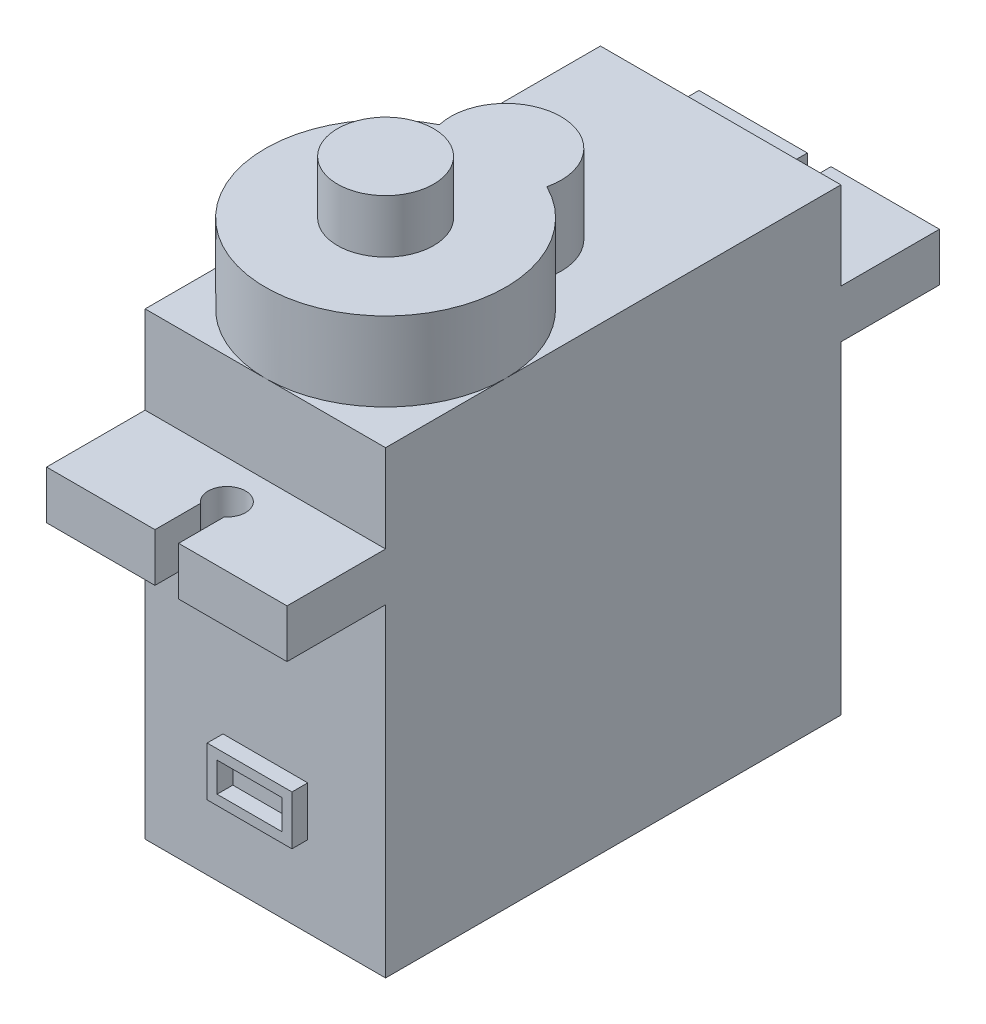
SolidWorks part; units mm, degrees
ref_plane "Plan de face" through (0, 0, 0) normal (0, 0, 1) x (1, 0, 0)
ref_plane "Plan de dessus" through (0, 0, 0) normal (0, 1, 0) x (1, 0, 0)
ref_plane "Plan de droite" through (0, 0, 0) normal (1, 0, 0) x (0, 0, -1)
sketch "Esquisse1" plane through (0, 0, 0) normal (1, 0, 0) x (0, 0, -1)
  line L0 (0, -9.5432) -> (0, 26.3061) construction
  line L1 (-6.5687, 0) -> (43.0147, 0) construction
  line L2 (-6.5687, 23.3) -> (43.0147, 23.3) construction
  line L3 (23.1, -9.5432) -> (23.1, 26.3061) construction
  line L4 (11.55, 26.3061) -> (11.55, 16.4856) construction
  line L5 (18.1943, 18.85) -> (34.5394, 18.85) construction
  line L6 (18.1943, 16.4) -> (34.5394, 16.4) construction
  line L7 (23.1, 23.3) -> (23.1, 18.85)
  line L8 (28.1, 26.3061) -> (28.1, -9.5432) construction
  line L9 (23.1, 18.85) -> (28.1, 18.85)
  line L10 (28.1, 18.85) -> (28.1, 16.4)
  line L11 (28.1, 16.4) -> (23.1, 16.4)
  line L12 (23.1, 16.4) -> (23.1, 0)
  line L13 (0, 16.4) -> (0, 0)
  line L14 (-5, 16.4) -> (0, 16.4)
  line L15 (-5, 18.85) -> (-5, 16.4)
  line L16 (0, 18.85) -> (-5, 18.85)
  line L17 (0, 23.3) -> (0, 18.85)
  line L18 (0, 0) -> (23.1, 0)
  line L19 (0, 23.3) -> (23.1, 23.3)
  dimension "D1" = 23.1
  dimension "D2" = 23.3
  dimension "D3" = 5
  dimension "D4" = 4.45
  dimension "D5" = 2.45
  dimension "D6" = 11.55
extrude "Boss.-Extru.1" add sketch "Esquisse1" along normal blind 12.2
sketch "Esquisse2" plane through (0, 23.3, 0) normal (0, 1, 0) x (1, 0, 0)
  line L0 (6.1, -3.0777) -> (6.1, 12.8836) construction
  line L1 (18.2298, 0) -> (-0.4412, 0) construction
  line L2 (18.2298, 6.1) -> (4.1736, 6.1) construction
  arc A0 (3.3747, 11.5574) -> (8.8253, 11.5574) centre (6.1, 6.1) ccw
  arc A1 (8.8253, 11.5574) -> (3.3747, 11.5574) centre (6.1, 12.2) ccw
  dimension "D1" = 6.1
extrude "Boss.-Extru.2" add sketch "Esquisse2" along normal blind 4
sketch "Esquisse3" plane through (0, 27.3, 0) normal (0, 1, 0) x (1, 0, 0)
  circle A0 centre (6.1, 6.1) radius 2.44
extrude "Boss.-Extru.3" add sketch "Esquisse3" along normal blind 2.7
sketch "Esquisse4" plane through (0, 0, 0) normal (0, 0, 1) x (1, 0, 0)
  line L0 (6.1, -2.2335) -> (6.1, 8.3432) construction
  line L1 (17.3465, 0) -> (-0.7202, 0) construction
  line L2 (17.2202, 6.6) -> (-0.7202, 6.6) construction
  line L3 (14.6657, 4.1) -> (-1.6138, 4.1) construction
  line L4 (8.25, -6.3433) -> (8.25, 7.9158) construction
  line L5 (3.95, -6.3433) -> (3.95, 7.9158) construction
  line L7 (3.95, 4.1) -> (8.25, 4.1)
  line L8 (3.95, 4.1) -> (3.95, 6.6)
  line L9 (3.95, 6.6) -> (8.25, 6.6)
  line L10 (8.25, 4.1) -> (8.25, 6.6)
  line L11 (4.45, 4.6) -> (7.75, 4.6)
  line L12 (4.45, 4.6) -> (4.45, 6.1)
  line L13 (4.45, 6.1) -> (7.75, 6.1)
  line L14 (7.75, 4.6) -> (7.75, 6.1)
  dimension "D1" = 6.6
  dimension "D2" = 2.5
  dimension "D3" = 4.3
  dimension "D4" = 2.15
  dimension "D5" = 0.5
  dimension "D6" = 0.5
extrude "Boss.-Extru.4" add sketch "Esquisse4" along normal blind 0.8
sketch "Esquisse5" plane through (0, 18.85, 0) normal (0, 1, 0) x (1, 0, 0)
  line L0 (19.3997, 28.1) -> (-1.0099, 28.1) construction
  line L1 (6.1, -6.293) -> (6.1, 15.4135) construction
  line L2 (6.7, -8.6928) -> (6.7, 1.5335) construction
  line L3 (5.5, -8.6928) -> (5.5, 2.2393) construction
  line L4 (1.9214, -1.95) -> (18.6917, -1.95) construction
  line L5 (19.3997, 11.55) -> (-1.0099, 11.55) construction
  line L6 (5.5, -2.6865) -> (5.5, -5)
  line L7 (5.5, -5) -> (6.7, -5)
  line L8 (12.2, -5) -> (0, -5) construction
  line L9 (6.7, -5) -> (6.7, -2.6865)
  line L10 (5.5, 25.7865) -> (5.5, 28.1)
  line L11 (6.7, 28.1) -> (6.7, 25.7865)
  line L12 (5.5, 28.1) -> (6.7, 28.1)
  line L13 (12.2, -5) -> (-4.6687, -5) construction
  arc A0 (6.7, -2.6865) -> (5.5, -2.6865) centre (6.1, -1.95) ccw
  arc A1 (6.7, 25.7865) -> (5.5, 25.7865) centre (6.1, 25.05) cw
  dimension "D1" = 1.2
  dimension "D2" = 0.6
  dimension "D3" = 16.55
  dimension "D4" = 13.5
extrude "Enlèv. mat.-Extru.3" cut sketch "Esquisse5" against normal blind 2.5
